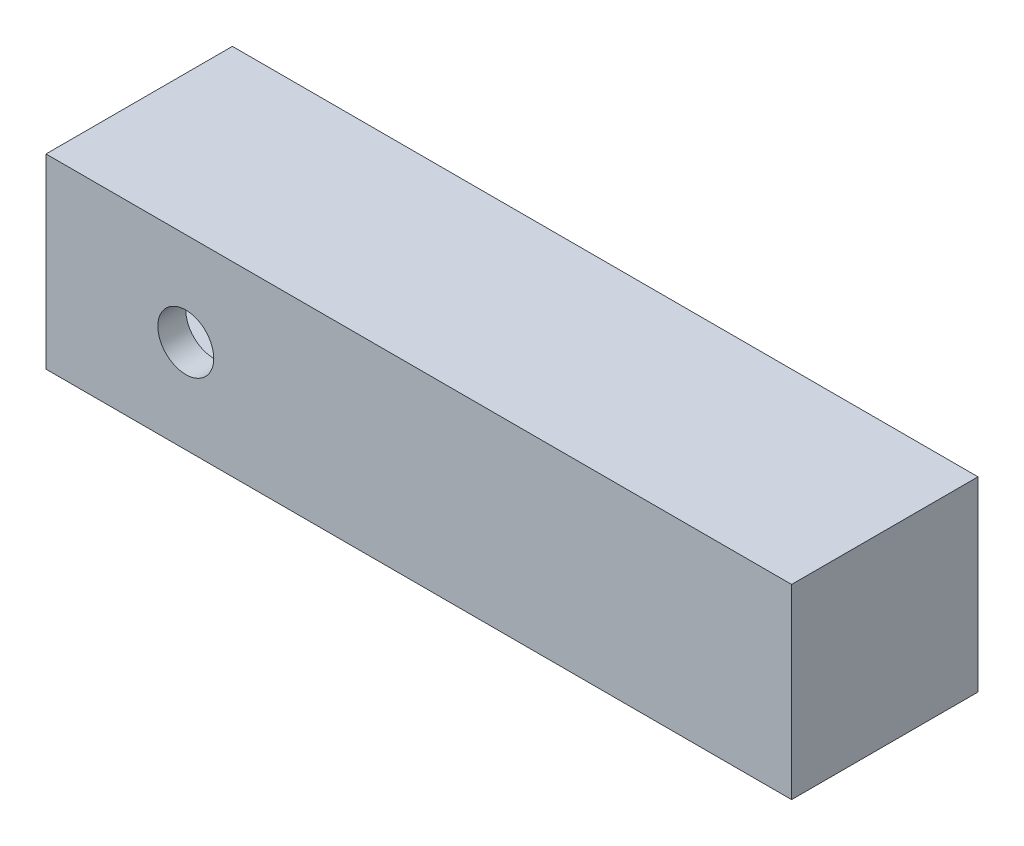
SolidWorks part; units mm, degrees
ref_plane "Front Plane" through (0, 0, 0) normal (0, 0, 1) x (1, 0, 0)
ref_plane "Top Plane" through (0, 0, 0) normal (0, 1, 0) x (1, 0, 0)
ref_plane "Right Plane" through (0, 0, 0) normal (1, 0, 0) x (0, 0, -1)
sketch "Sketch1" plane through (0, 0, 0) normal (0, 0, 1) x (1, 0, 0)
  line L0 (0, 0) -> (101.6, 0)
  line L1 (101.6, 0) -> (101.6, -25.4)
  line L2 (101.6, -25.4) -> (0, -25.4)
  line L3 (0, -25.4) -> (0, 0)
  dimension "D1" = 101.6
  dimension "D2" = 25.4
extrude "Boss-Extrude1" add sketch "Sketch1" along normal mid plane 25.4
sketch "Sketch2" plane through (0, 0, 0) normal (-1, 0, 0) x (0, 0, 1)
  line L0 (12.7, 0) -> (12.7, -25.4) construction
  line L1 (-8.89, -3.81) -> (8.89, -3.81)
  line L2 (-8.89, -3.81) -> (-8.89, -21.59)
  line L3 (-8.89, -21.59) -> (8.89, -21.59)
  line L4 (8.89, -3.81) -> (8.89, -21.59)
  line L5 (-8.89, -3.81) -> (8.89, -21.59) construction
  line L6 (-8.89, -21.59) -> (8.89, -3.81) construction
  point P0 (0, -12.7)
  point P5 (0, 0)
  point P9 (12.7, -12.7)
  dimension "D1" = 17.78
sketch "Sketch3" plane through (0, -25.4, 0) normal (0, -1, 0) x (1, 0, 0)
  line L0 (0, 12.7) -> (0, -12.7) construction
  line L1 (62.4847, 10.0326) -> (82.55, 10.0326)
  line L2 (62.4847, 10.0326) -> (62.4847, -10.0326)
  line L3 (62.4847, -10.0326) -> (82.55, -10.0326)
  line L4 (82.55, 10.0326) -> (82.55, -10.0326)
  line L5 (62.4847, 10.0326) -> (82.55, -10.0326) construction
  line L6 (62.4847, -10.0326) -> (82.55, 10.0326) construction
  point P0 (72.5174, 0)
  point P5 (0, 0)
  dimension "D1" = 82.55
sketch "Sketch7" plane through (0, 0, 0) normal (0, 0, 1) x (1, 0, 0)
  line L0 (0, -12.7) -> (72.5174, -12.7)
  line L1 (0, -3.81) -> (0, -21.59) construction
  line L2 (72.5174, -12.7) -> (72.5174, -25.4)
sweep "Cut-Sweep2" cut profiles "Sketch2" path "Sketch7"
sketch "Sketch9" plane through (0, 0, 0) normal (0, 0, 1) x (1, 0, 0)
  line L0 (0, 0) -> (0, -25.4) construction
  circle A0 centre (19.05, -12.7) radius 3.81
  point P2 (13.6184, -12.7753)
  point P5 (0, 0)
  point P6 (0, -12.7)
  dimension "D1" = 7.62
  dimension "D2" = 19.05
extrude "Cut-Extrude1" cut sketch "Sketch9" against normal through all both and the other way through all
